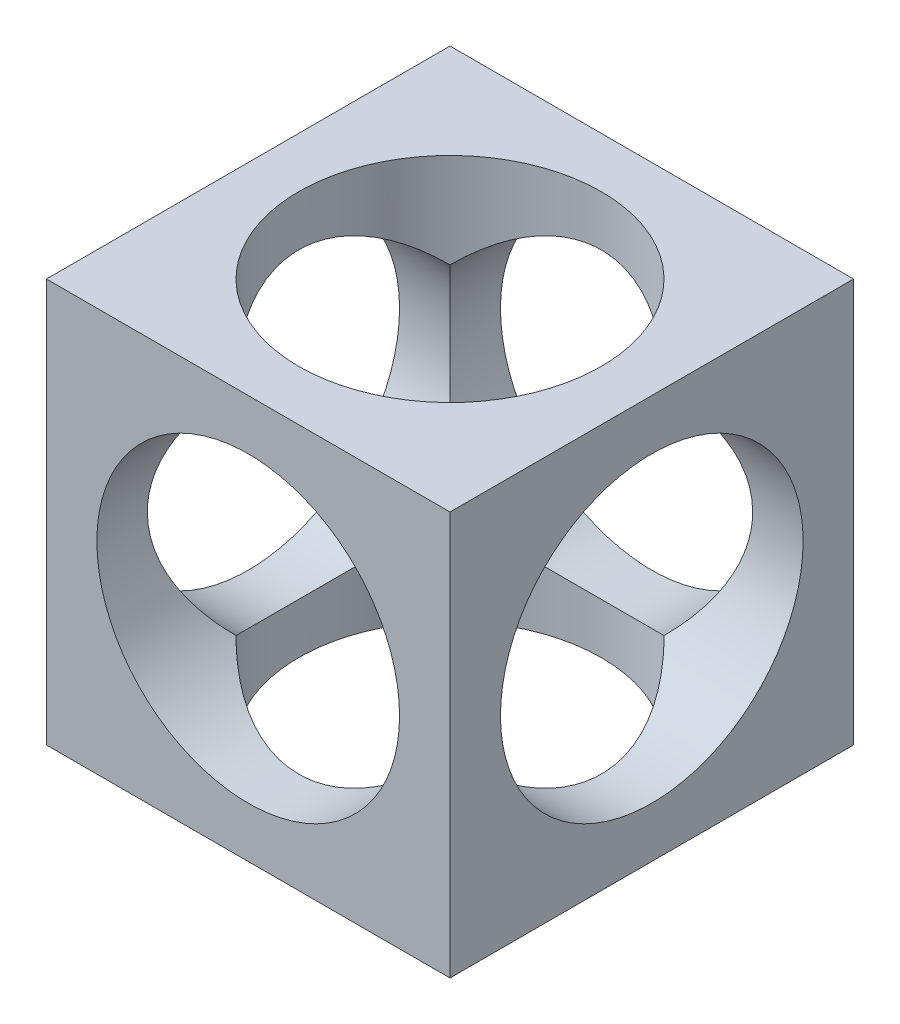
SolidWorks part; units mm, degrees
ref_plane "Front Plane" through (0, 0, 0) normal (0, 0, 1) x (1, 0, 0)
ref_plane "Top Plane" through (0, 0, 0) normal (0, 1, 0) x (1, 0, 0)
ref_plane "Right Plane" through (0, 0, 0) normal (1, 0, 0) x (0, 0, -1)
sketch "Sketch1" plane through (0, 0, 0) normal (0, 1, 0) x (1, 0, 0)
  line L5 (-20, -20) -> (20, -20)
  line L6 (-20, -20) -> (-20, 20)
  line L7 (-20, 20) -> (20, 20)
  line L8 (20, -20) -> (20, 20)
  line L9 (-20, -20) -> (20, 20) construction
  line L10 (-20, 20) -> (20, -20) construction
  point P0 (0, 0)
  dimension "D1" = 40
  dimension "D2" = 40
extrude "Boss-Extrude2" add sketch "Sketch1" along normal mid plane 40
sketch "Sketch2" plane through (20, 0, 0) normal (1, 0, 0) x (0, 0, -1)
  circle A0 centre (0, 0) radius 15
  dimension "D1" = 30
extrude "Cut-Extrude1" cut sketch "Sketch2" against normal through all
sketch "Sketch3" plane through (0, 0, -20) normal (0, 0, -1) x (-1, 0, 0)
  circle A0 centre (0, 0) radius 15
  dimension "D1" = 30
extrude "Cut-Extrude2" cut sketch "Sketch3" against normal through all
sketch "Sketch4" plane through (0, 20, 0) normal (0, 1, 0) x (1, 0, 0)
  circle A0 centre (0, 0) radius 15
  dimension "D1" = 30
extrude "Cut-Extrude3" cut sketch "Sketch4" against normal through all
